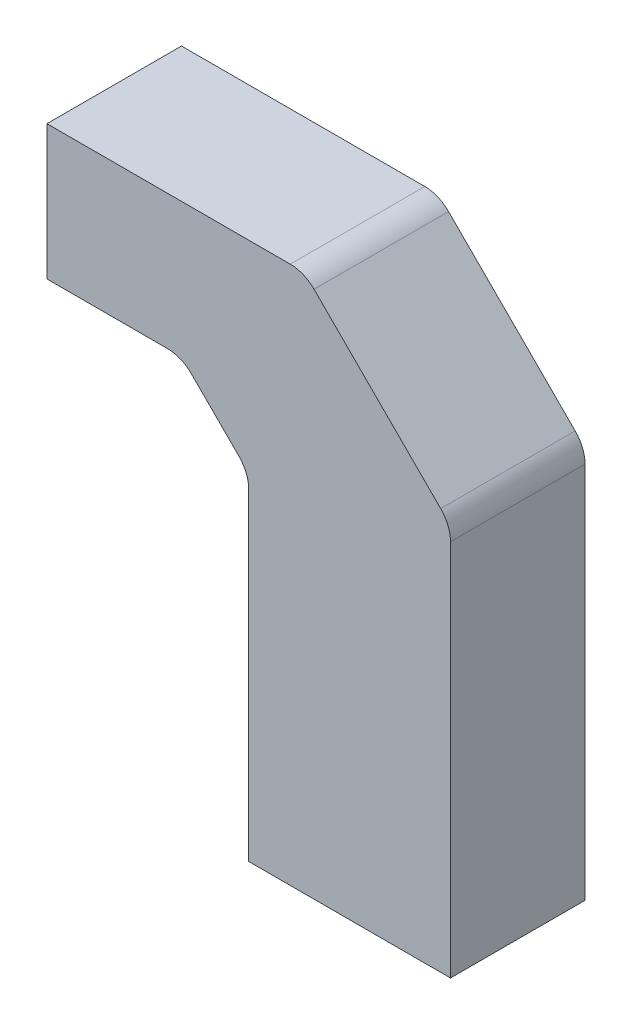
SolidWorks part; units mm, degrees
ref_plane "Front Plane" through (0, 0, 0) normal (0, 0, 1) x (1, 0, 0)
ref_plane "Top Plane" through (0, 0, 0) normal (0, 1, 0) x (1, 0, 0)
ref_plane "Right Plane" through (0, 0, 0) normal (1, 0, 0) x (0, 0, -1)
sketch "Sketch1" plane through (0, 0, 0) normal (0, 0, 1) x (1, 0, 0)
  line L0 (-40.2884, 57.5694) -> (-40.2884, 32.1694)
  line L1 (-40.2884, 32.1694) -> (-14.8884, 32.1694)
  line L2 (-14.8884, 32.1694) -> (-2.1884, 19.4694)
  line L3 (-2.1884, 19.4694) -> (-2.1884, -44.0306)
  line L4 (-2.1884, -44.0306) -> (35.9116, -44.0306)
  line L5 (35.9116, -44.0306) -> (35.9116, 29.9389)
  line L6 (8.281, 57.5694) -> (35.9116, 29.9389)
  line L7 (8.281, 57.5694) -> (-40.2884, 57.5694)
  dimension "D1" = 25.4
  dimension "D2" = 25.4
  dimension "D3" = 38.1
  dimension "D4" = 63.5
  dimension "D5" = 45
  dimension "D6" = 76.2
  dimension "D7" = 45
extrude "Extrude1" add sketch "Sketch1" along normal blind 25.4
fillet "Fillet1" radius 6.35 4 edges at (35.9116, 29.9389, 12.7) (8.281, 57.5694, 12.7) (-2.1884, 19.4694, 12.7) (-14.8884, 32.1694, 12.7)
sketch "Sketch2" plane through (-40.2884, 0, 0) normal (-1, 0, 0) x (0, 0, 1)
  line L0 (25.4, 57.5694) -> (0, 32.1694) construction
  line L1 (0, 32.1694) -> (25.4, 32.1694) construction
  line L2 (25.4, 32.1694) -> (0, 57.5694) construction
  circle A0 centre (12.7, 44.8694) radius 6.35
  dimension "D1" = 12.7
extrude "Cut-Extrude1" cut sketch "Sketch2" against normal blind 25.4
sketch "Sketch3" plane through (0, 32.1694, 0) normal (0, -1, 0) x (1, 0, 0)
  line L0 (-46.5066, 12.7) -> (-21.8906, 12.7) construction
  line L1 (-40.2884, 25.4) -> (-17.5187, 25.4) construction
  line L2 (-40.2884, 25.4) -> (-40.2884, 0) construction
  circle A0 centre (-27.5884, 12.7) radius 4.7625
  dimension "D3" = 9.525
  dimension "D1" = 12.7
  dimension "D2" = 12.7
extrude "Cut-Extrude3" cut sketch "Sketch3" against normal blind 5.08
